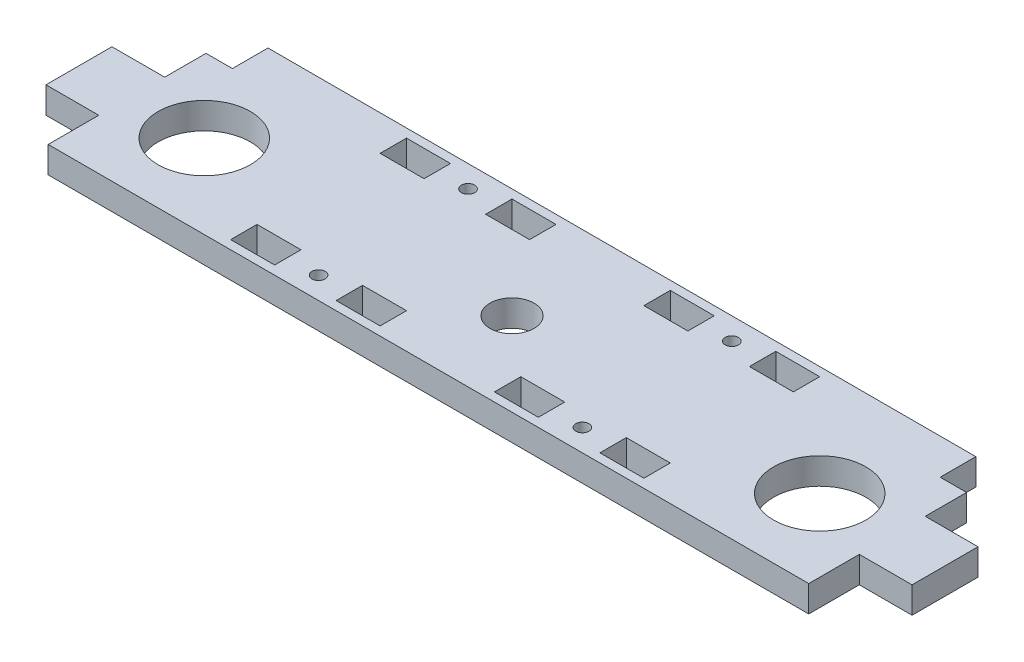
SolidWorks part; units mm, degrees
ref_plane "Спереди" through (0, 0, 0) normal (0, 0, 1) x (1, 0, 0)
ref_plane "Сверху" through (0, 0, 0) normal (0, 1, 0) x (1, 0, 0)
ref_plane "Справа" through (0, 0, 0) normal (1, 0, 0) x (0, 0, -1)
sketch "Эскиз1" plane through (0, 0, 0) normal (0, 1, 0) x (1, 0, 0)
  line L0 (0, 79.5064) -> (0, 0) construction
  line L1 (0, 0) -> (114.1377, 0) construction
  line L2 (0, -5) -> (0, -19)
  line L3 (86.5, -19) -> (86.5, -7.5)
  line L4 (30, 25) -> (30, 20) construction
  line L5 (13, 23) -> (23, 23)
  line L6 (13, 23) -> (13, 17)
  line L7 (70, 0) -> (70, 14.1666) construction
  line L8 (13, 17) -> (23, 17)
  line L9 (23, 23) -> (23, 17)
  line L10 (0, 25) -> (0, 5)
  line L11 (86.5, -7.5) -> (98.5, -7.5)
  line L12 (98.5, -7.5) -> (98.5, 7.5)
  line L13 (98.5, 7.5) -> (86.5, 7.5)
  line L14 (86.5, 7.5) -> (86.5, 16.9)
  line L15 (13, 20) -> (30, 20) construction
  line L16 (18, 23) -> (18, 17) construction
  line L17 (47, 23) -> (47, 17)
  line L18 (47, 23) -> (37, 23)
  line L19 (37, 23) -> (37, 17)
  line L20 (47, 17) -> (37, 17)
  line L21 (80.5, 25) -> (80.5, 16.9)
  line L22 (80.5, 16.9) -> (86.5, 16.9)
  line L23 (0, 3) -> (-23.8247, 3) construction
  line L24 (18, -17) -> (18, -11) construction
  line L25 (80.5, 25) -> (0, 25)
  line L26 (13, -14) -> (30, -14) construction
  line L27 (30, -19) -> (30, -14) construction
  line L28 (47, -11) -> (37, -11)
  line L29 (37, -17) -> (37, -11)
  line L30 (47, -17) -> (37, -17)
  line L31 (47, -17) -> (47, -11)
  line L32 (23, -17) -> (23, -11)
  line L33 (13, -11) -> (23, -11)
  line L34 (13, -17) -> (13, -11)
  line L35 (13, -17) -> (23, -17)
  line L57 (0, -19) -> (86.5, -19)
  arc A0 (0, -5) -> (0, 5) centre (0, 0) ccw
  circle A1 centre (70, 0) radius 10.5
  circle A2 centre (30, 20) radius 1.5
  circle A3 centre (30, -14) radius 1.5
  point P50 (98.5, 0)
  dimension "D2" = 10
  dimension "D3" = 21
  dimension "D4" = 140
  dimension "D7" = 3
  dimension "D1" = 173
  dimension "D5" = 44
  dimension "D6" = 19
  dimension "D8" = 10
  dimension "D9" = 15
  dimension "D10" = 12
  dimension "D11" = 6
  dimension "D12" = 30
  dimension "D13" = 12
  dimension "D14" = 5
  dimension "D16" = 6
  dimension "D17" = 8.1
  dimension "D18" = 22
extrude "Бобышка-Вытянуть1" add sketch "Эскиз1" along normal blind 6
mirror "Зеркальное отражение1" about plane through (0, 6, -25) normal (1, 0, 0)
